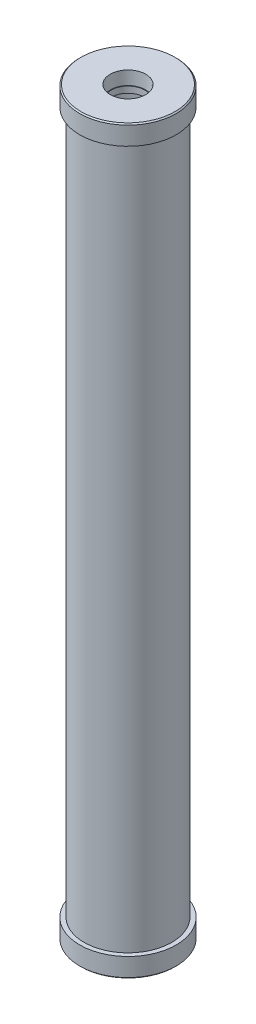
SolidWorks part; units mm, degrees
ref_plane "Front Plane" through (0, 0, 0) normal (0, 0, 1) x (1, 0, 0)
ref_plane "Top Plane" through (0, 0, 0) normal (0, 1, 0) x (1, 0, 0)
ref_plane "Right Plane" through (0, 0, 0) normal (1, 0, 0) x (0, 0, -1)
sketch "Sketch1" plane through (0, 0, 0) normal (0, 1, 0) x (1, 0, 0)
  circle A0 centre (0, 0) radius 57.15
  circle A1 centre (0, 0) radius 50.546
  dimension "D1" = 114.3
  dimension "D2" = 6.604
extrude "Boss-Extrude1" add sketch "Sketch1" along normal blind 965.2
sketch "Sketch2" plane through (0, 0, 0) normal (0, 1, 0) x (1, 0, 0)
  circle A0 centre (0, 0) radius 62.865
  dimension "D1" = 125.73
extrude "Boss-Extrude2" add sketch "Sketch2" along normal blind 25.4
hole_wizard "1-1/2 NPT Tapped Hole1" positions "Sketch4" profile "Sketch3" size "1-1/2" standard "ANSI Inch"
sketch "Sketch4" plane through (0, 0, 0) normal (0, 1, 0) x (1, 0, 0)
  point P0 (0, 0)
sketch "Sketch3" plane through (0, 0, 0) normal (1, 0, 0) x (0, 0, -1)
  line L0 (0, 0) -> (0, 41.5656)
  line L1 (21.8313, 28.448) -> (0, 41.5656)
  line L2 (-21.8313, 28.448) -> (0, 41.5656) construction
  line L3 (21.8313, 28.448) -> (21.8313, 17.272)
  line L4 (21.8313, 17.272) -> (22.6259, 17.272)
  line L5 (22.6259, 17.272) -> (23.143, 0)
  line L6 (-22.6259, 17.272) -> (-23.143, 0) construction
  line L7 (23.143, 0) -> (0, 0)
  line L8 (0, -6.35) -> (0, 107.95) construction
  line L11 (-21.8313, 17.272) -> (-22.6259, 17.272) construction
  dimension "Tap Drill Dia." = 43.6626
  dimension "Tap Drill Depth" = 28.448
  dimension "Thread Dia." = 46.2861
  dimension "Thread Angle" = 3.43
  dimension "Thread Depth" = 17.272
  dimension "Drill Angle" = 118
ref_plane "Plane1" through (0, 965.2, 0) normal (0, 1, 0) x (1, 0, 0)
sketch "Sketch5" plane through (0, 965.2, 0) normal (0, 1, 0) x (1, 0, 0)
  circle A0 centre (0, 0) radius 62.865
  dimension "D1" = 125.73
extrude "Boss-Extrude3" add sketch "Sketch5" against normal blind 25.4
hole_wizard "1-1/2 NPT Tapped Hole2" positions "Sketch7" profile "Sketch6" size "1-1/2" standard "ANSI Inch"
sketch "Sketch7" plane through (0, 965.2, 0) normal (0, 1, 0) x (1, 0, 0)
  point P0 (0, 0)
sketch "Sketch6" plane through (0, 965.2, 0) normal (1, 0, 0) x (0, 0, 1)
  line L0 (0, 0) -> (0, 41.5656)
  line L1 (21.8313, 28.448) -> (0, 41.5656)
  line L2 (-21.8313, 28.448) -> (0, 41.5656) construction
  line L3 (21.8313, 28.448) -> (21.8313, 17.272)
  line L4 (21.8313, 17.272) -> (22.6259, 17.272)
  line L5 (22.6259, 17.272) -> (23.143, 0)
  line L6 (-22.6259, 17.272) -> (-23.143, 0) construction
  line L7 (23.143, 0) -> (0, 0)
  line L8 (0, -6.35) -> (0, 107.95) construction
  line L11 (-21.8313, 17.272) -> (-22.6259, 17.272) construction
  dimension "Tap Drill Dia." = 43.6626
  dimension "Tap Drill Depth" = 28.448
  dimension "Thread Dia." = 46.2861
  dimension "Thread Angle" = 3.43
  dimension "Thread Depth" = 17.272
  dimension "Drill Angle" = 118
chamfer "Chamfer1" distance 1.524 angle 45 2 edges at (0, 0, 62.865) (0, 965.2, 62.865)
